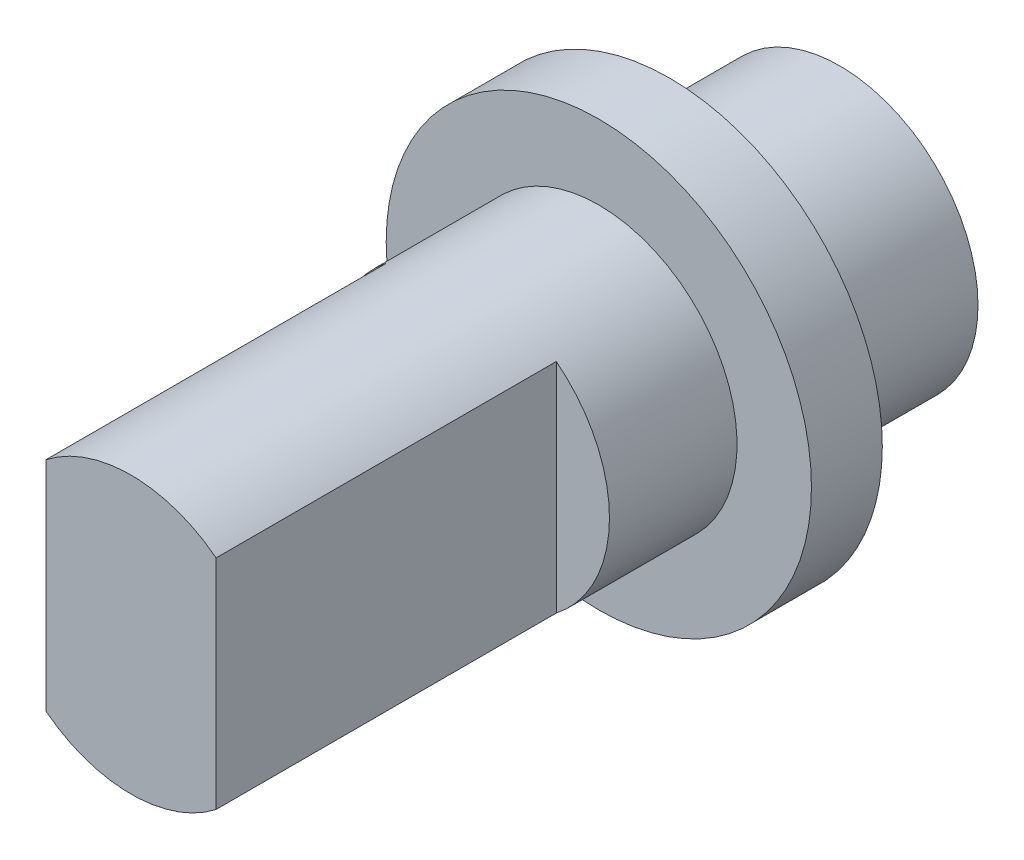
SolidWorks part; units mm, degrees
ref_plane "Front Plane" through (0, 0, 0) normal (0, 0, 1) x (1, 0, 0)
ref_plane "Top Plane" through (0, 0, 0) normal (0, 1, 0) x (1, 0, 0)
ref_plane "Right Plane" through (0, 0, 0) normal (1, 0, 0) x (0, 0, -1)
sketch "Sketch1" plane through (0, 0, 0) normal (0, 0, 1) x (1, 0, 0)
  circle A0 centre (0, 0) radius 2.4765
  dimension "D1" = 4.953
extrude "Boss-Extrude1" add sketch "Sketch1" along normal blind 12.7
sketch "Sketch2" plane through (0, 0, 12.7) normal (0, 0, 1) x (1, 0, 0)
  line L0 (0, 2.7259) -> (0, -3.3367) construction
  line L1 (1.524, 2.1406) -> (1.524, -2.4634)
  line L2 (-3.0144, 2.1406) -> (-1.524, 2.1406)
  line L3 (-3.0144, 2.1406) -> (-3.0144, -2.4634)
  line L4 (-3.0144, -2.4634) -> (-1.524, -2.4634)
  line L5 (-1.524, 2.1406) -> (-1.524, -2.4634)
  line L6 (3.0144, -2.4634) -> (1.524, -2.4634)
  line L7 (3.0144, 2.1406) -> (3.0144, -2.4634)
  line L8 (3.0144, 2.1406) -> (1.524, 2.1406)
  dimension "D1" = 1.524
extrude "Cut-Extrude1" cut sketch "Sketch2" against normal blind 6.096
sketch "Sketch3" plane through (0, 0, 0) normal (1, 0, 0) x (0, 0, -1)
  line L0 (-14.2783, 0) -> (1.6828, 0) construction
  line L1 (-12.7, -1.952) -> (-12.7, 1.952) construction
  line L2 (-4.318, 0) -> (-3.048, 0)
  line L3 (-4.318, 0) -> (-4.318, 3.81)
  line L4 (-4.318, 3.81) -> (-3.048, 3.81)
  line L5 (-3.048, 0) -> (-3.048, 3.81)
  dimension "D1" = 8.382
  dimension "D2" = 1.27
  dimension "D3" = 3.81
revolve "Revolve1" add sketch "Sketch3" angle 360 about L0
